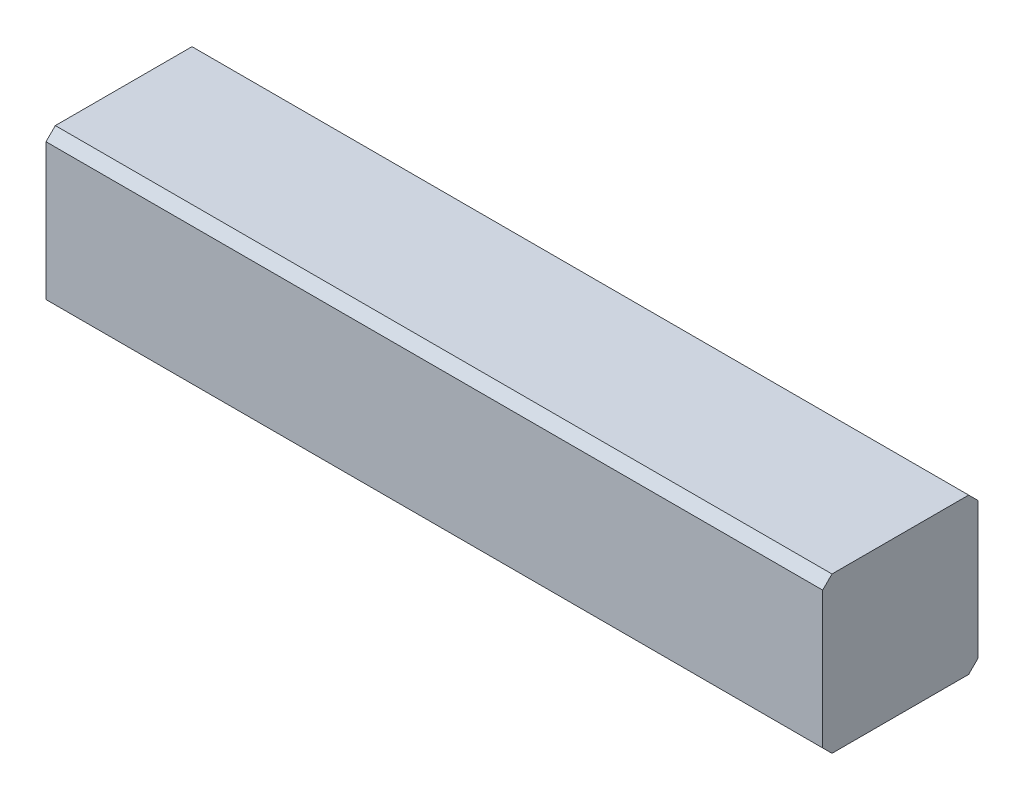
SolidWorks part; units mm, degrees
ref_plane "Front X-Y" through (0, 0, 0) normal (0, 0, 1) x (1, 0, 0)
ref_plane "Top X-Z" through (0, 0, 0) normal (0, 1, 0) x (1, 0, 0)
ref_plane "Right Y-Z" through (0, 0, 0) normal (1, 0, 0) x (0, 0, -1)
ref_plane "Plane1" through (0, 0, 0) normal (0, 0, 1) x (1, 0, 0)
sketch "Sketch1" plane through (0, 0, 0) normal (0, 0, 1) x (1, 0, 0)
  line L0 (0, 0) -> (25, 0)
  line L1 (25, 0) -> (25, 5)
  line L2 (25, 5) -> (0, 5)
  line L3 (0, 5) -> (0, 0)
extrude "Boss-Extrude1" add sketch "Sketch1" along normal blind 5
ref_plane "Plane2" through (0, 0, 0) normal (1, 0, 0) x (0, 0, -1)
sketch "Sketch2" plane through (0, 0, 0) normal (1, 0, 0) x (0, 0, -1)
  line L0 (-7.5, 7.5) -> (-7.5, -2.5)
  line L1 (-7.5, -2.5) -> (2.5, -2.5)
  line L2 (2.5, -2.5) -> (2.5, 7.5)
  line L3 (2.5, 7.5) -> (-7.5, 7.5)
  line L4 (-5, 0.3) -> (-4.7, 0)
  line L5 (-4.7, 0) -> (-0.3, 0)
  line L6 (-0.3, 0) -> (0, 0.3)
  line L7 (0, 0.3) -> (0, 4.7)
  line L8 (0, 4.7) -> (-0.3, 5)
  line L9 (-0.3, 5) -> (-4.7, 5)
  line L10 (-4.7, 5) -> (-5, 4.7)
  line L11 (-5, 4.7) -> (-5, 0.3)
extrude "Cut-Extrude1" cut sketch "Sketch2" along normal blind 25
